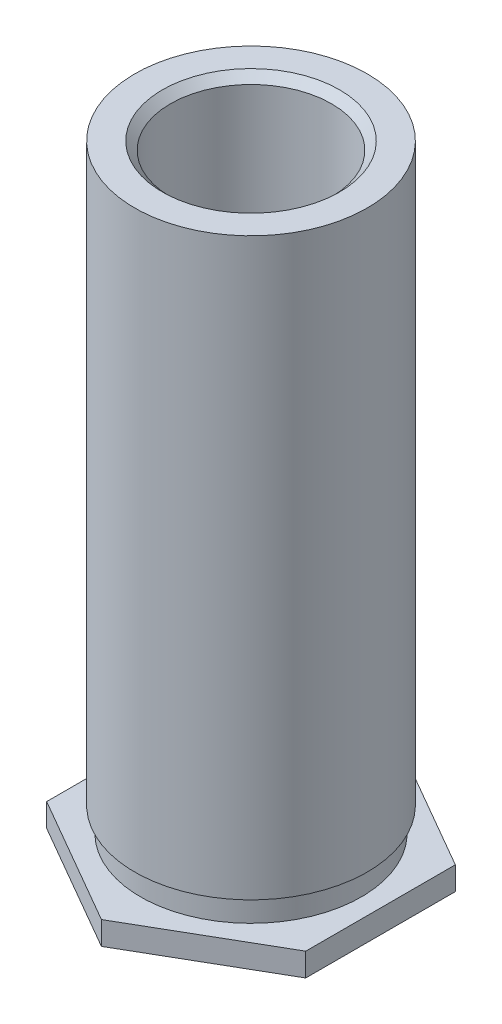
SolidWorks part; units mm, degrees
ref_plane "Plane1" through (0, 0, 0) normal (0, 0, 1) x (1, 0, 0)
ref_plane "Plane2" through (0, 0, 0) normal (0, 1, 0) x (1, 0, 0)
ref_plane "Plane3" through (0, 0, 0) normal (1, 0, 0) x (0, 0, -1)
sketch "BodySke" plane through (0, 0, 0) normal (0, 0, 1) x (1, 0, 0)
  line L0 (3.556, 0) -> (4.5964, 0)
  line L1 (4.5964, 0) -> (4.5964, 0.7112)
  line L2 (4.5964, 0.7112) -> (3.3782, 0.7112)
  line L3 (2.4638, 18.8036) -> (2.4638, 0.2515)
  line L4 (3.556, 1.458) -> (3.3782, 1.458)
  line L5 (3.3782, 1.458) -> (3.3782, 0.7112)
  line L6 (3.556, 0.0051) -> (3.556, 0)
  line L7 (2.7102, 0.0051) -> (3.556, 0.0051)
  line L8 (3.556, 19.05) -> (2.7102, 19.05)
  line L9 (0, 0) -> (0, 15.24) construction
  line L10 (2.7102, 19.05) -> (2.4638, 18.8036)
  line L11 (3.556, 19.05) -> (3.556, 1.458)
  line L12 (2.4638, 0.2515) -> (2.7102, 0.0051)
  dimension "D1" = 0.0051
  dimension "E_dia" = 9.1928
  dimension "D2" = 45
  dimension "C_dia" = 7.112
  dimension "D3" = 45
  dimension "Clinching_ht" = 0.7112
  dimension "Length" = 19.05
  dimension "Groove_wid" = 0.7468
  dimension "Groove_dia" = 6.7564
  dimension "Thru_dia" = 4.9276
  dimension "Chamfer_dia" = 5.4204
revolve "Body" add sketch "BodySke" angle 360 about L9
ref_plane "Plane4" through (0, -0.5486, 0) normal (0, 1, 0) x (-1, 0, 0)
sketch "HexDieSke" plane through (0, 0.7112, 0) normal (0, 1, 0) x (-1, 0, 0)
  line L0 (0, 4.5754) -> (3.9624, 2.2877)
  line L1 (3.9624, 2.2877) -> (3.9624, -2.2877)
  line L2 (3.9624, -2.2877) -> (0, -4.5754)
  line L3 (0, -4.5754) -> (-3.9624, -2.2877)
  line L4 (-3.9624, -2.2877) -> (-3.9624, 2.2877)
  line L5 (-3.9624, 2.2877) -> (0, 4.5754)
  circle A1 centre (0, 0) radius 3.9624 construction
  circle A2 centre (0, 0) radius 4.5754 construction
  circle A3 centre (0, 0) radius 4.6091
  dimension "Width_across_flats" = 7.9248
  dimension "OD" = 9.2182
extrude "HexDie" cut sketch "HexDieSke" against normal blind 0.7112
equation "' \"Length@BodySke\" = 0.75"
equation "' \"Thru_dia@BodySke\" = 0.194"
equation "' \"C_dia@BodySke\" = 0.28"
equation "' \"Width_across_flats@HexDieSke\" = 0.312"
equation "\"E_dia@BodySke\" = \"Width_across_flats@HexDieSke\" * 1.16"
equation "\"Chamfer_dia@BodySke\" = \"Thru_dia@BodySke\" * 1.1"
equation "\"Clinching_ht@BodySke\" = \"C_dia@BodySke\" * 0.1"
equation "\"Groove_dia@BodySke\" = \"C_dia@BodySke\" * 0.95"
equation "\"Groove_wid@BodySke\" = \"Clinching_ht@BodySke\" * 1.05"
equation "\"Depth@HexDie\" = \"Clinching_ht@BodySke\""
equation "\"OD@HexDieSke\" =  \"Width_across_flats@HexDieSke\" * 1.16 + 0.001"
